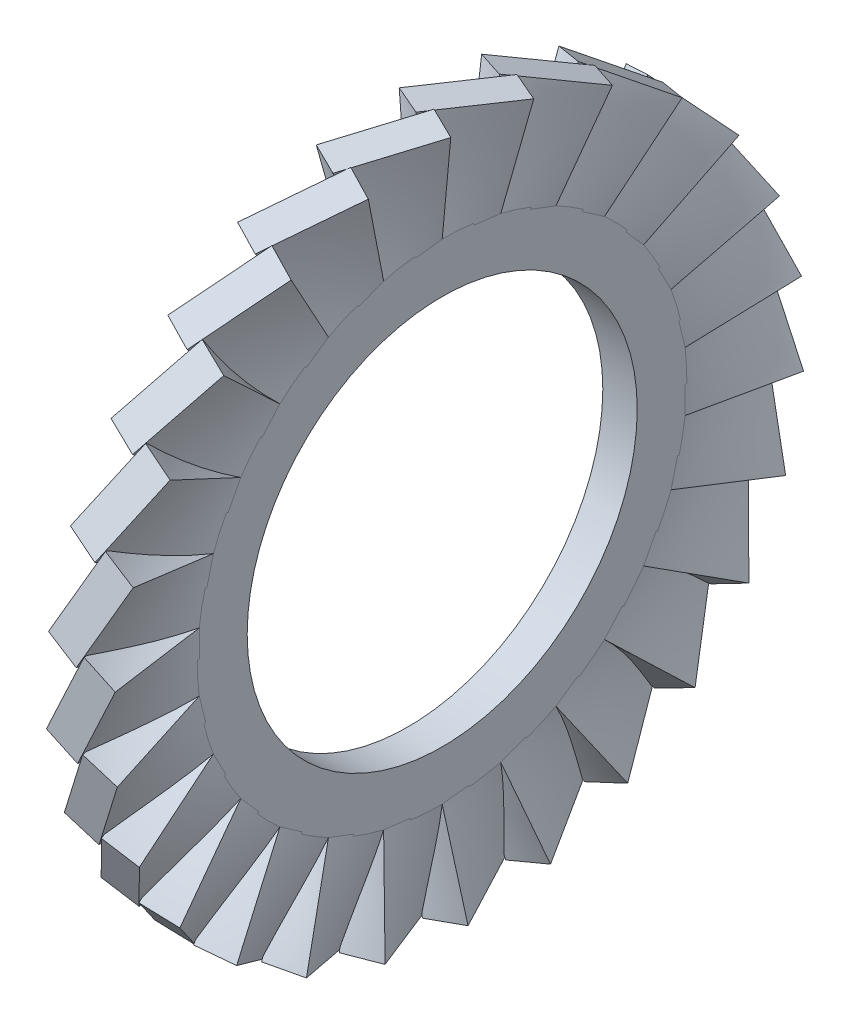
SolidWorks part; units mm, degrees
ref_plane "Plan1" through (0, 0, 0) normal (0, 0, 1) x (1, 0, 0)
ref_plane "Plan2" through (0, 0, 0) normal (0, 1, 0) x (1, 0, 0)
ref_plane "Plan3" through (0, 0, 0) normal (1, 0, 0) x (0, 0, -1)
sketch "Esquisse1" plane through (0, 0, 0) normal (0, 0, 1) x (1, 0, 0)
  line L0 (-4, 0) -> (4, 0) construction
  line L1 (0.45, 5.1) -> (-0.45, 5.1)
  line L2 (-0.45, 5.1) -> (-0.45, 6.4)
  line L3 (-0.45, 6.4) -> (0.45, 6.4)
  line L4 (0, 0) -> (0, 8) construction
  line L5 (0.45, 5.1) -> (0.45, 6.4)
  point P10 (0, 6.4)
  point P11 (0, 5.1)
  dimension "D1" = 5.1
  dimension "D2" = 6.4
  dimension "D3" = 0.45
revolve "Ame rondelle" add sketch "Esquisse1" angle 360 about L0
ref_plane "Plan4" through (0, 0, 6.3533) normal (0, 0, 1) x (1, 0, 0)
ref_plane "Plan5" through (0, 0, 9) normal (0, 0, 1) x (1, 0, 0)
sketch "Esquisse2" plane through (0, 0, 6.3533) normal (0, 0, 1) x (1, 0, 0)
  line L0 (0.45, 0.7714) -> (0.45, -0.7714)
  line L1 (-0.45, 0.7714) -> (0.45, 0.7714)
  line L3 (-0.45, 6.4) -> (-0.45, -6.4) construction
  line L4 (-0.45, 0.7714) -> (-0.45, -0.7714)
  line L5 (-1, 0) -> (1, 0) construction
  line L6 (-4, 0) -> (4, 0) construction
  line L7 (0, 0) -> (0, 1) construction
  line L11 (-0.45, -0.7714) -> (0.45, -0.7714)
  point P6 (0, -0.7714)
  point P14 (0, 0.7714)
  point P18 (0.45, 0)
  point P21 (-0.45, 0)
  dimension "D1" = 0.7714
sketch "Esquisse4" plane through (0, 0, 9) normal (0, 0, 1) x (1, 0, 0)
  line L0 (0, 0) -> (0.45, 0.965) construction
  line L1 (0.45, -6.4) -> (0.45, 6.4) construction
  line L2 (0, 0) -> (0.6568, -0.3063) construction
  line L3 (0, 0) -> (0, 1) construction
  line L4 (0.0843, 1.2456) -> (0.9, 0.8653)
  line L5 (0.9, 0.8653) -> (-0.0843, -1.2456)
  line L7 (0.0843, 1.2456) -> (-0.9, -0.8653)
  line L8 (-0.9, -0.8653) -> (-0.0843, -1.2456)
  point P12 (0.4922, 1.0554)
  point P14 (-0.4078, 0.1902)
  point P15 (0.4078, -0.1902)
  dimension "D1" = 25
  dimension "D2" = 0.45
  dimension "D3" = 0.9
loft "1 dent" add profiles "Esquisse2", "Esquisse4"
pattern_circular "Répétition dents" count 26 over 360 about axis through (-4, 0, 0) along (1, 0, 0) of "1 dent"
ref_plane "Plan d'appui 1" through (0.9, 0, 0) normal (1, 0, 0) x (0, 0, -1)
ref_plane "Plan d'appui 2" through (-0.9, 0, 0) normal (1, 0, 0) x (0, 0, -1)
equation "\"D2@Esquisse4\" = \"D3@Esquisse1\""
equation "\"D1@Plan d'appui 1\" = \"D3@Esquisse1\"*2"
equation "\"D1@Plan d'appui 2\" = \"D3@Esquisse1\"*2"
